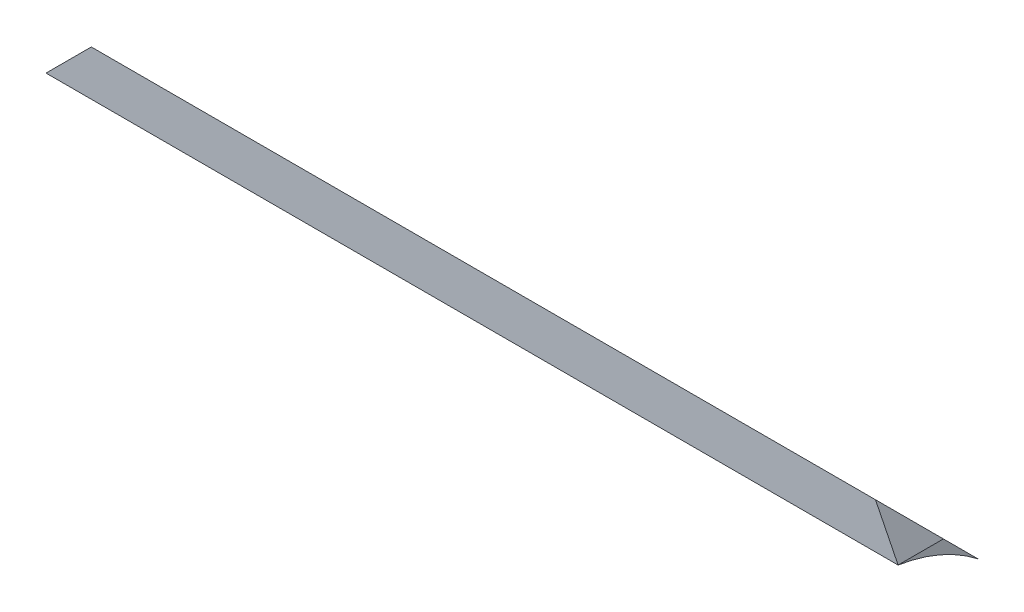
SolidWorks part; units mm, degrees
ref_plane "Front Plane" through (0, 0, 0) normal (0, 0, 1) x (1, 0, 0)
ref_plane "Top Plane" through (0, 0, 0) normal (0, 1, 0) x (1, 0, 0)
ref_plane "Right Plane" through (0, 0, 0) normal (1, 0, 0) x (0, 0, -1)
sketch "Sketch1" plane through (0, 0, 0) normal (0, 1, 0) x (1, 0, 0)
  line L1 (0, 0) -> (101.6, 0)
  line L2 (0, 0) -> (0, 12.7)
  line L3 (0, 12.7) -> (101.6, 12.7)
  line L4 (101.6, 0) -> (101.6, 12.7)
  dimension "D1" = 101.6
  dimension "D2" = 12.7
extrude "Extrude1" add sketch "Sketch1" along normal blind 12.7
sketch "Sketch2" plane through (101.6, 0, 0) normal (1, 0, 0) x (0, 0, -1)
  line L0 (0, 12.7) -> (12.7, 0)
  line L1 (0, 12.7) -> (12.7, 12.7)
  line L2 (12.7, 12.7) -> (12.7, 0)
extrude "Cut-Extrude1" cut sketch "Sketch2" against normal through all
sketch "Sketch3" plane through (101.6, 0, 0) normal (1, 0, 0) x (0, 0, -1)
  line L0 (0, 4.3705) -> (0, 22.1081)
  line L1 (0, 22.1081) -> (3.175, 22.1081)
  line L2 (3.175, 22.1081) -> (3.175, 4.1248)
  arc A0 (0, 4.3705) -> (3.175, 4.1248) centre (0, -16.267) ccw
  dimension "D1" = 20.6375
  dimension "D2" = 3.175
extrude "Cut-Extrude2" cut sketch "Sketch3" against normal through all
sketch "Sketch5" plane through (0, 0, 0) normal (0, 0, 1) x (1, 0, 0)
  line L0 (101.6, 0) -> (101.6, 4.1248)
  line L1 (101.6, 4.1248) -> (76.2, 54.9248)
  line L2 (76.2, 54.9248) -> (50.8, 54.9248)
  line L3 (50.8, 54.9248) -> (0, 4.1248)
  line L4 (101.6, 0) -> (0, 0)
  line L5 (0, 4.1248) -> (0, 0)
  line L6 (0, 4.1248) -> (101.6, 4.1248) construction
  dimension "D1" = 25.4
  dimension "D2" = 50.8
  dimension "D3" = 50.8
extrude "Cut-Extrude7" cut sketch "Sketch5" against normal through all flip side to cut
